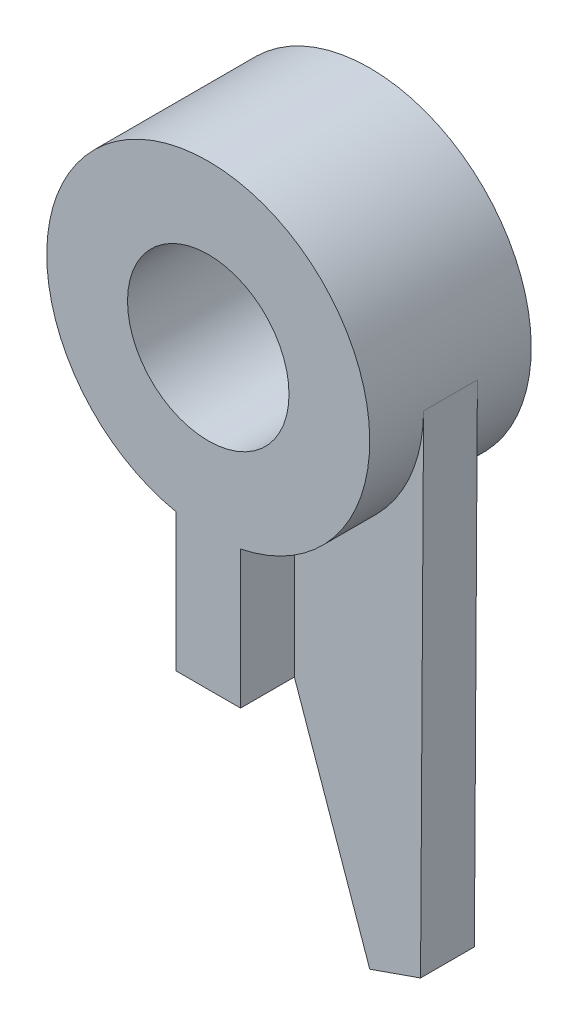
SolidWorks part; units mm, degrees
ref_plane "前视基准面" through (0, 0, 0) normal (0, 0, 1) x (1, 0, 0)
ref_plane "上视基准面" through (0, 0, 0) normal (0, 1, 0) x (1, 0, 0)
ref_plane "右视基准面" through (0, 0, 0) normal (1, 0, 0) x (0, 0, -1)
sketch "草图1" plane through (0, 0, 0) normal (0, 0, 1) x (1, 0, 0)
  line L0 (-6, -29.3939) -> (-6, -55)
  line L1 (-6, -55) -> (6, -55)
  line L2 (6, -55) -> (6, -29.3939)
  arc A0 (6, -29.3939) -> (-6, -29.3939) centre (0, 0) ccw
  circle A1 centre (0, 0) radius 15
  dimension "D1" = 60
  dimension "D5" = 30
  dimension "D2" = 55
  dimension "D3" = 12
  dimension "D4" = 6
extrude "拉伸1" add sketch "草图1" along normal mid plane 30
sketch "草图2" plane through (0, 0, 0) normal (0, 0, 1) x (1, 0, 0)
  line L0 (6, -55) -> (6, -29.3939) construction
  line L1 (6, -55) -> (6, -29.3939)
  line L2 (6, -55) -> (20, -95)
  line L3 (20, -95) -> (29.4386, -91.6965)
  line L4 (29.4386, -91.6965) -> (29.9994, -0.1839)
  line L5 (-6, -55) -> (6, -55) construction
  arc A0 (6, -29.3939) -> (-6, -29.3939) centre (0, 0) ccw construction
  arc A1 (6, -29.3939) -> (29.9994, -0.1839) centre (0, 0) ccw
  dimension "D1" = 40
  dimension "D2" = 10
  dimension "D3" = 14
extrude "拉伸2" add sketch "草图2" along normal mid plane 10
